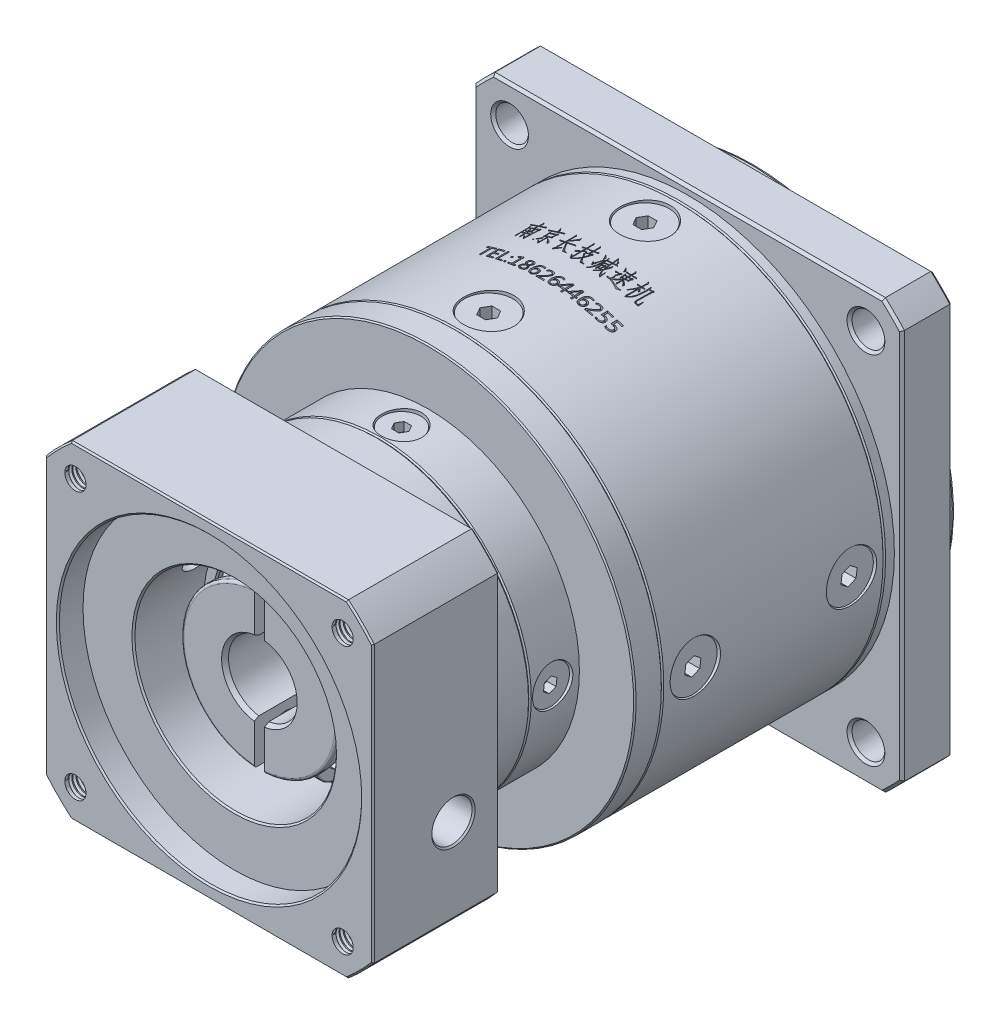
SolidWorks part; units mm, degrees
ref_plane "前视基准面" through (0, 0, 0) normal (0, 0, 1) x (1, 0, 0)
ref_plane "上视基准面" through (0, 0, 0) normal (0, 1, 0) x (1, 0, 0)
ref_plane "右视基准面" through (0, 0, 0) normal (1, 0, 0) x (0, 0, -1)
imported_body "14-60-75-M5-2-solid1"
imported_body "14-60-75-M5-2-solid2"
imported_body "14-60-75-M5-2-solid3"
imported_body "14-60-75-M5-2-solid4"
imported_body "14-60-75-M5-2-solid5"
imported_body "ZF80-K15-L2-F60-9-solid1"
imported_body "ZF80-K15-L2-F60-9-solid2"
imported_body "ZF80-K15-L2-F60-9-solid3"
imported_body "ZF80-K15-L2-F60-9-solid4"
imported_body "ZF80-K15-L2-F60-9-solid5"
imported_body "ZF80-K15-L2-F60-9-solid6"
imported_body "ZF80-K15-L2-F60-9-solid7"
imported_body "ZF80-K15-L2-F60-9-solid8"
imported_body "ZF80-K15-L2-F60-9-solid9"
imported_body "ZF80-K15-L2-F60-9-solid10"
imported_body "ZF80-K15-L2-F60-9-solid11"
imported_body "ZF80-K15-L2-F60-9-solid12"
imported_body "ZF80-K15-L2-F60-9-solid13"
sketch "草图1" plane through (0, 0, -58.7556) normal (0, 0, -1) x (-1, 0, 0)
  circle A0 centre (63.2208, 21.6586) radius 10.9605
  dimension "D1" = 21.921
extrude "凸台-拉伸1" add sketch "草图1" along normal blind 5
